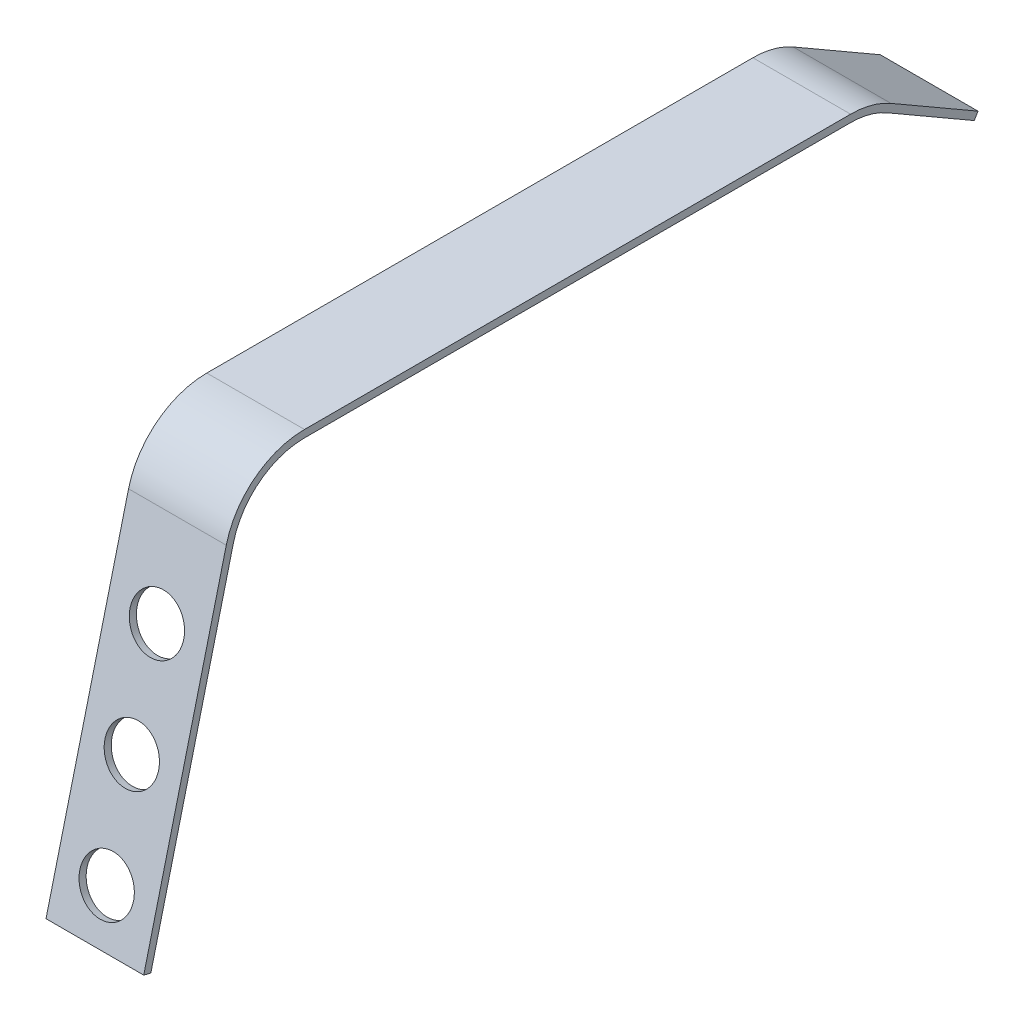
SolidWorks part; units mm, degrees
ref_plane "Спереди" through (0, 0, 0) normal (0, 0, 1) x (1, 0, 0)
ref_plane "Сверху" through (0, 0, 0) normal (0, 1, 0) x (1, 0, 0)
ref_plane "Справа" through (0, 0, 0) normal (1, 0, 0) x (0, 0, -1)
sketch "Эскиз10" plane through (0, 0, 0) normal (1, 0, 0) x (0, 0, -1)
  line L0 (-25.6811, 0.5396) -> (-29.818, -16.0525)
  line L1 (0, 0) -> (-21, 0)
  line L2 (0, 0) -> (0, -0.3)
  line L3 (0, -0.3) -> (-21, -0.3)
  line L4 (-21.1452, -0.2822) -> (-25.0263, 0.6855)
  line L5 (-29.818, -16.0525) -> (-29.5269, -16.1251)
  line L6 (-29.5269, -16.1251) -> (-25.39, 0.467)
  line L7 (-21.0726, 0.0089) -> (-24.9538, 0.9766)
  arc A0 (-21, -0.3) -> (-21.1452, -0.2822) centre (-21, 0.3) cw
  arc A1 (-25.6811, 0.5396) -> (-24.9538, 0.9766) centre (-25.0989, 0.3944) cw
  arc A2 (-21, 0) -> (-21.0726, 0.0089) centre (-21, 0.3) cw
  arc A3 (-25.39, 0.467) -> (-25.0263, 0.6855) centre (-25.0989, 0.3944) cw
  point P11 (-25.5812, -0.3)
  dimension "D2" = 0.3
  dimension "D3" = 0.6
  dimension "D5" = 0.3
  dimension "D1" = 0.3
  dimension "D4" = 104
  dimension "D6" = 4
  dimension "D7" = 4.3
  dimension "D8" = 17.1
  dimension "D9" = 21
extrude "Бобышка-Вытянуть5" add sketch "Эскиз10" along normal blind 4
sketch "Эскиз11" plane through (0, 6.0598, 24.3047) normal (0, 0.2419, 0.9703) x (1, 0, 0)
  line L0 (2, -20.7893) -> (2, -12.2893) construction
  line L1 (4, -22.7893) -> (0, -22.7893) construction
  line L2 (2, -22.7893) -> (2, -20.7893) construction
  line L3 (2, -16.5393) -> (-3.0152, -16.5393) construction
  circle A0 centre (2, -20.7893) radius 1.1
  circle A1 centre (2, -12.2893) radius 1.1
  circle A2 centre (2, -16.5393) radius 1.1
  dimension "D1" = 2.2
  dimension "D2" = 2
  dimension "D3" = 8.5
extrude "Вырез-Вытянуть6" cut sketch "Эскиз11" against normal through all
sketch "Эскиз12" plane through (4, 0, 0) normal (1, 0, 0) x (0, 0, -1)
  line L0 (0, 0) -> (4.3301, -2.5)
  line L1 (0, 0) -> (-0.15, -0.2598)
  line L2 (4.3301, -2.5) -> (4.1801, -2.7598)
  line L3 (-0.15, -0.2598) -> (4.1801, -2.7598)
  line L5 (-21, -0.3) -> (0, -0.3) construction
  dimension "D1" = 0.3
  dimension "D2" = 5
  dimension "D3" = 30
extrude "Бобышка-Вытянуть6" add sketch "Эскиз12" against normal up to surface (4 mm away)
fillet "Скругление6" radius 3 1 edges at (2, -0.3, 0.0804)
fillet "Скругление5" radius 3.3 1 edges at (2, 0, 0)
sketch "Эскиз13" plane through (4, 0, 0) normal (1, 0, 0) x (0, 0, -1)
  line L0 (-25.6811, 0.5396) -> (-29.818, -16.0525) construction
  line L1 (-21, 0) -> (-25.8156, 0)
  line L2 (-21, 0) -> (-21, -0.3)
  line L3 (-21, -0.3) -> (-25.8156, -0.3)
  line L4 (-25.8156, 0) -> (-25.8156, -0.3)
extrude "Бобышка-Вытянуть7" add sketch "Эскиз13" against normal up to surface (4 mm away)
sketch "Эскиз14" plane through (4, 0, 0) normal (1, 0, 0) x (0, 0, -1)
  line L1 (-25.3058, 0) -> (-21, 0)
  line L2 (-25.3058, 0) -> (-25.3058, 1.8308)
  line L3 (-25.3058, 1.8308) -> (-21, 1.8308)
  line L4 (-21, 0) -> (-21, 1.8308)
extrude "Вырез-Вытянуть7" cut sketch "Эскиз14" against normal through all
sketch "Эскиз16" plane through (4, 0, 0) normal (1, 0, 0) x (0, 0, -1)
  line L0 (-25.5812, -0.3) -> (-0.8842, -0.3) construction
  line L1 (-29.5269, -16.1251) -> (-25.5812, -0.3) construction
  line L2 (-23.2374, -3.3) -> (-26.1483, -2.5742) construction
  line L3 (-23.2374, -3.3) -> (-23.2374, -0.3) construction
  line L4 (-26.1483, -2.5742) -> (-25.5812, -0.3)
  line L6 (-23.2374, -0.3) -> (-25.5812, -0.3)
  line L7 (-25.5812, -0.3) -> (-0.8842, -0.3) construction
  arc A0 (-23.2374, -0.3) -> (-26.1483, -2.5742) centre (-23.2374, -3.3) ccw
  dimension "D1" = 3
extrude "Бобышка-Вытянуть12" add sketch "Эскиз16" against normal up to surface (4 mm away)
sketch "Эскиз17" plane through (4, 0, 0) normal (1, 0, 0) x (0, 0, -1)
  line L0 (-23.2374, -3.3) -> (-23.2374, 0) construction
  line L1 (-23.2374, -3.3) -> (-26.4394, -2.5017) construction
  line L2 (-25.6811, 0.5396) -> (-29.818, -16.0525) construction
  line L3 (-26.4394, -2.5017) -> (-26.4406, -2.5017)
  line L4 (-26.4406, -2.5017) -> (-26.4406, 1.4762)
  line L5 (-26.4406, 1.4762) -> (-23.2374, 1.4762)
  line L6 (-23.2374, 1.4762) -> (-23.2374, 0)
  arc A0 (-23.2374, 0) -> (-26.4394, -2.5017) centre (-23.2374, -3.3) ccw
extrude "Вырез-Вытянуть8" cut sketch "Эскиз17" against normal through all
